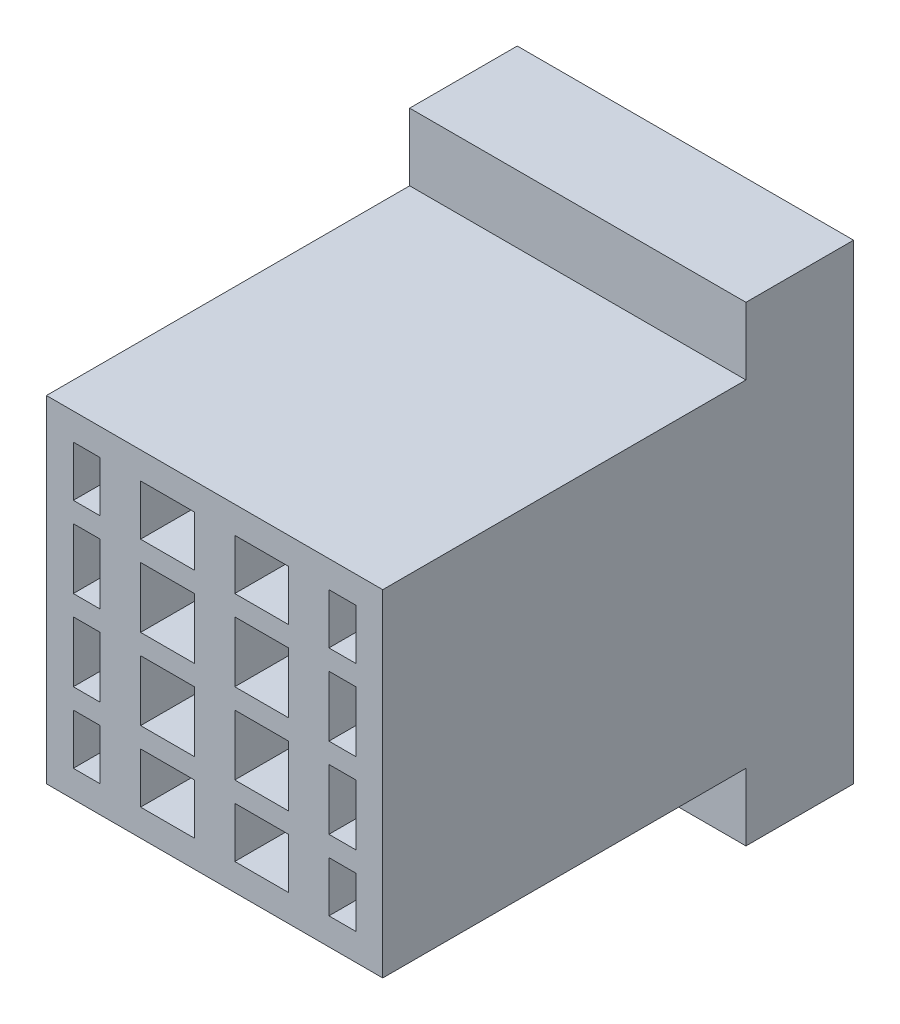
SolidWorks part; units mm, degrees
ref_plane "前视基准面" through (0, 0, 0) normal (0, 0, 1) x (1, 0, 0)
ref_plane "上视基准面" through (0, 0, 0) normal (0, 1, 0) x (1, 0, 0)
ref_plane "右视基准面" through (0, 0, 0) normal (1, 0, 0) x (0, 0, -1)
sketch "草图8" plane through (0, 0, 0) normal (0, 0, 1) x (1, 0, 0)
  line L0 (0, 7.8741) -> (0, -9.2542) construction
  line L1 (-12.5, -12.5) -> (12.5, -12.5)
  line L2 (-12.5, -12.5) -> (-12.5, 12.5)
  line L3 (-12.5, 12.5) -> (12.5, 12.5)
  line L4 (12.5, -12.5) -> (12.5, 12.5)
  line L5 (-12.5, -12.5) -> (12.5, 12.5) construction
  line L6 (-12.5, 12.5) -> (12.5, -12.5) construction
  line L7 (-16.0619, 0) -> (15.5648, 0) construction
  line L8 (-3.5, 7.8741) -> (-3.5, -9.2542) construction
  line L9 (-9.5, 7.8741) -> (-9.5, -9.2542) construction
  line L10 (5.5, 10.5) -> (1.5, 10.5)
  line L15 (-5.5, -10.5) -> (-1.5, -10.5)
  line L20 (-5.5, -10.5) -> (-5.5, 10.5)
  line L21 (-5.5, 10.5) -> (-1.5, 10.5)
  line L26 (-1.5, -10.5) -> (-1.5, 10.5)
  line L27 (-5.5, -10.5) -> (-1.5, 10.5) construction
  line L28 (-5.5, 10.5) -> (-1.5, -10.5) construction
  line L29 (-10.5, -10.5) -> (-8.5, -10.5)
  line L30 (-10.5, -10.5) -> (-10.5, 10.5)
  line L31 (-10.5, 10.5) -> (-8.5, 10.5)
  line L32 (-8.5, -10.5) -> (-8.5, 10.5)
  line L33 (-10.5, -10.5) -> (-8.5, 10.5) construction
  line L34 (-10.5, 10.5) -> (-8.5, -10.5) construction
  line L35 (1.5, -10.5) -> (1.5, 10.5)
  line L36 (5.5, -10.5) -> (1.5, -10.5)
  line L37 (5.5, -10.5) -> (5.5, 10.5)
  line L38 (10.5, 10.5) -> (8.5, 10.5)
  line L39 (8.5, -10.5) -> (8.5, 10.5)
  line L40 (10.5, -10.5) -> (8.5, -10.5)
  line L41 (10.5, -10.5) -> (10.5, 10.5)
  point P0 (0, 0)
  point P14 (-7, 0)
  point P15 (-3.5, 0)
  point P17 (-3, 0)
  point P21 (-9.5, 0)
  point P22 (-9, 0)
  dimension "D1" = 3.5
  dimension "D2" = 6
extrude "凸台-拉伸7" add sketch "草图8" along normal blind 25
sketch "草图9" plane through (0, 0, 0) normal (0, 0, -1) x (-1, 0, 0)
  line L1 (-12.5, -12.5) -> (12.5, -12.5)
  line L2 (-12.5, -12.5) -> (-12.5, 12.5)
  line L3 (-12.5, 12.5) -> (12.5, 12.5)
  line L4 (12.5, -12.5) -> (12.5, 12.5)
  line L5 (-12.5, -12.5) -> (12.5, 12.5) construction
  line L6 (-12.5, 12.5) -> (12.5, -12.5) construction
  point P0 (0, 0)
extrude "凸台-拉伸8" add sketch "草图9" along normal blind 2
sketch "草图11" plane through (0, 0, -2) normal (0, 0, -1) x (-1, 0, 0)
  line L5 (-12.5, -17.5) -> (12.5, -17.5)
  line L6 (-12.5, -17.5) -> (-12.5, 17.5)
  line L7 (-12.5, 17.5) -> (12.5, 17.5)
  line L8 (12.5, -17.5) -> (12.5, 17.5)
  line L9 (-12.5, -17.5) -> (12.5, 17.5) construction
  line L10 (-12.5, 17.5) -> (12.5, -17.5) construction
  point P0 (0, 0)
extrude "凸台-拉伸9" add sketch "草图11" along normal blind 6
sketch "草图12" plane through (0, 0, -8) normal (0, 0, -1) x (-1, 0, 0)
  line L1 (-10.5, -15) -> (10.5, -15)
  line L2 (-10.5, -15) -> (-10.5, 15)
  line L3 (-10.5, 15) -> (10.5, 15)
  line L4 (10.5, -15) -> (10.5, 15)
  line L5 (-10.5, -15) -> (10.5, 15) construction
  line L6 (-10.5, 15) -> (10.5, -15) construction
  point P0 (0, 0)
extrude "切除-拉伸1" cut sketch "草图12" against normal blind 4
sketch "草图14" plane through (0, 0, 25) normal (0, 0, 1) x (1, 0, 0)
  line L0 (-16.6961, 0) -> (20.7273, 0) construction
  line L1 (-12.5, 12.5) -> (-12.5, -12.5) construction
  line L2 (12.5, -0.75) -> (-12.5, -0.75)
  line L3 (12.5, -0.75) -> (12.5, 0.75)
  line L4 (12.5, 0.75) -> (-12.5, 0.75)
  line L5 (-12.5, -0.75) -> (-12.5, 0.75)
  line L6 (12.5, -0.75) -> (-12.5, 0.75) construction
  line L7 (12.5, 0.75) -> (-12.5, -0.75) construction
  line L12 (12.5, 5.25) -> (-12.5, 5.25)
  line L13 (12.5, 5.25) -> (12.5, 6.75)
  line L14 (12.5, 6.75) -> (-12.5, 6.75)
  line L15 (-12.5, 5.25) -> (-12.5, 6.75)
  line L16 (12.5, 5.25) -> (-12.5, 6.75) construction
  line L17 (12.5, 6.75) -> (-12.5, 5.25) construction
  line L18 (12.5, -6.75) -> (-12.5, -5.25) construction
  line L19 (12.5, -5.25) -> (-12.5, -6.75) construction
  line L20 (-12.5, -5.25) -> (-12.5, -6.75)
  line L21 (12.5, -6.75) -> (-12.5, -6.75)
  line L22 (12.5, -5.25) -> (12.5, -6.75)
  line L23 (12.5, -5.25) -> (-12.5, -5.25)
  point P3 (0, 0)
  point P11 (0, 6)
  point P19 (0, -6)
  dimension "D1" = 2
extrude "凸台-拉伸11" add sketch "草图14" against normal blind 25
sketch "草图15" plane through (0, 0, -8) normal (0, 0, -1) x (-1, 0, 0)
  line L1 (-12.5, -17.5) -> (12.5, -17.5)
  line L2 (-12.5, -17.5) -> (-12.5, 17.5)
  line L3 (-12.5, 17.5) -> (12.5, 17.5)
  line L4 (12.5, -17.5) -> (12.5, 17.5)
  line L5 (-12.5, -17.5) -> (12.5, 17.5) construction
  line L6 (-12.5, 17.5) -> (12.5, -17.5) construction
  point P0 (0, 0)
extrude "凸台-拉伸12" add sketch "草图15" along normal blind 2
